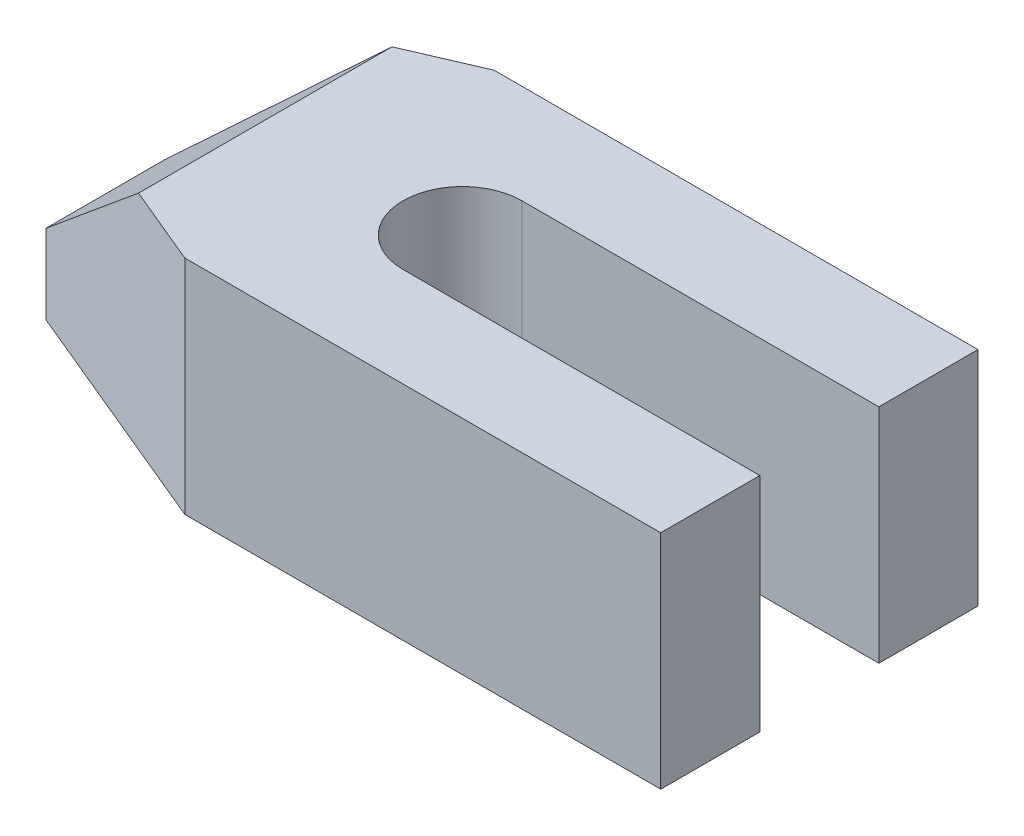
SolidWorks part; units mm, degrees
ref_plane "Face" through (0, 0, 0) normal (0, 0, 1) x (1, 0, 0)
ref_plane "Dessus" through (0, 0, 0) normal (0, 1, 0) x (1, 0, 0)
ref_plane "Droite" through (0, 0, 0) normal (1, 0, 0) x (0, 0, -1)
sketch "Esquisse1" plane through (0, 0, 0) normal (0, 1, 0) x (1, 0, 0)
  line L0 (45, -7.5) -> (45, -20)
  line L1 (0, -7.5) -> (45, -7.5)
  line L2 (-16, 20) -> (45, 20)
  line L3 (0, 7.5) -> (45, 7.5)
  line L6 (-15, -20) -> (45, -20)
  line L7 (45, 20) -> (45, 7.5)
  line L8 (-16, 20) -> (-45, 7.5)
  line L10 (-15, -20) -> (-45, -7.5)
  line L11 (-45, 7.5) -> (-45, -7.5)
  arc A0 (0, 7.5) -> (0, -7.5) centre (0, 0) ccw
  dimension "D1" = 45
  dimension "D4" = 7.5
  dimension "D2" = 40
  dimension "D3" = 20
  dimension "D5" = 45
  dimension "D7" = 45
  dimension "D8" = 60
extrude "Extrusion1" add sketch "Esquisse1" along normal blind 28
sketch "Esquisse2" plane through (-21.1538, 0, 20) normal (0, 0, -1) x (-1, 0, 0)
  line L0 (23.8462, 10) -> (3.8462, 28)
  line L1 (23.8462, 28) -> (23.8462, 0) construction
  line L2 (23.8462, 28) -> (-6.1538, 28) construction
  line L3 (66.9223, 41.2292) -> (3.8462, 28)
  line L4 (23.8462, 10) -> (66.9223, 41.2292)
  line L5 (23.8462, 0) -> (-6.1538, 0) construction
  dimension "D1" = 10
  dimension "D2" = 20
extrude "Enlèv. mat.-Extru.1" cut sketch "Esquisse2" along normal through all
